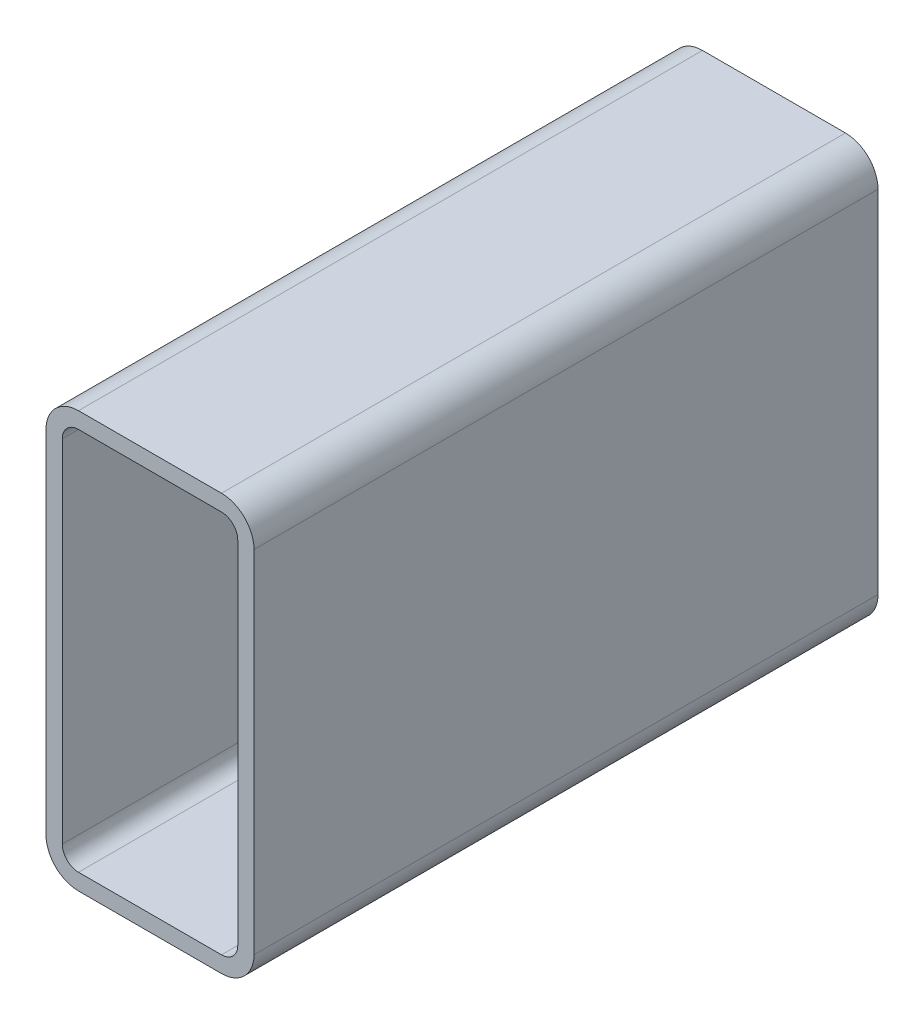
SolidWorks part; units mm, degrees
ref_plane "Front Plane" through (0, 0, 0) normal (0, 0, 1) x (1, 0, 0)
ref_plane "Top Plane" through (0, 0, 0) normal (0, 1, 0) x (1, 0, 0)
ref_plane "Right Plane" through (0, 0, 0) normal (1, 0, 0) x (0, 0, -1)
sketch "Sketch1" plane through (0, 0, 0) normal (0, 0, 1) x (1, 0, 0)
sketch_block_instance "HSS8x4x0.3125-1"
sketch_block "HSS8x4x0.3125"
extrude "Boss-Extrude1" add sketch "Sketch1" along normal blind 304.8
